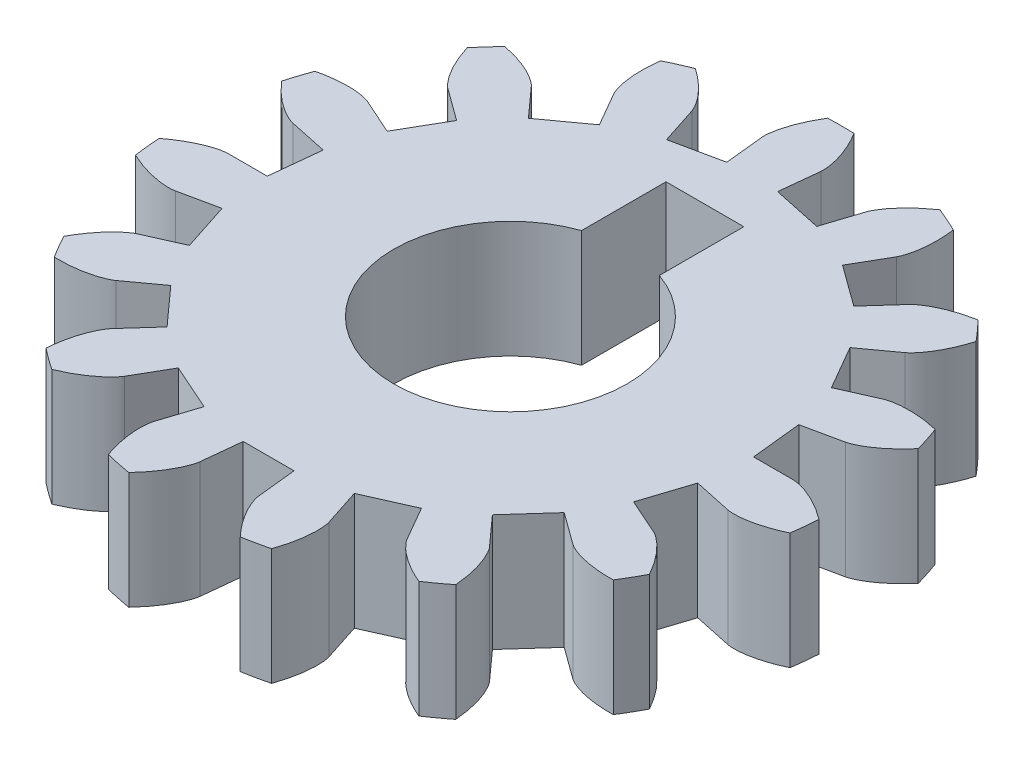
SolidWorks part; units mm, degrees
ref_plane "Front Plane" through (0, 0, 0) normal (0, 0, 1) x (1, 0, 0)
ref_plane "Top Plane" through (0, 0, 0) normal (0, 1, 0) x (1, 0, 0)
ref_plane "Right Plane" through (0, 0, 0) normal (1, 0, 0) x (0, 0, -1)
sketch "Sketch1" plane through (0, 0, 0) normal (0, 1, 0) x (1, 0, 0)
  line L0 (0, 0) -> (0, 3.6306) construction
  line L1 (0, 0) -> (-3.6306, 0) construction
  line L2 (0, 0) -> (-4.2267, -0.4442) construction
  line L3 (0, 0) -> (-3.5512, -0.7548) construction
  line L4 (0, 0) -> (-3.3167, -1.4767) construction
  circle A0 centre (0, 0) radius 3.75 construction
  circle A1 centre (0, 0) radius 3.6306 construction
  circle A2 centre (0, 0) radius 3.125 construction
  circle A3 centre (0, 0) radius 4.25 construction
  spline S0 degree 4 poles (-3.6306, 0) (-3.6359, 0) (-3.6507, -0.0005) (-3.6787, -0.0037) (-3.7239, -0.0119) (-3.7807, -0.0268) (-3.8526, -0.051) (-3.9353, -0.0858) (-4.0235, -0.1305) (-4.1162, -0.1857) (-4.2053, -0.2465) (-4.2909, -0.3123) (-4.3729, -0.3823) (-4.4682, -0.4722) (-4.5767, -0.5869) (-4.6942, -0.7301) (-4.816, -0.903) (-4.927, -1.0891) (-5.0252, -1.2799) (-5.1111, -1.4803) (-5.1846, -1.6795) (-5.2466, -1.8924) (-5.2965, -2.0922) (-5.3361, -2.3211) (-5.3633, -2.5075) (-5.3815, -2.7573) (-5.3869, -2.9058) (-5.3871, -3.0805) (-5.384, -3.1585) (-5.3821, -3.2065) knots 0 0 0 0 0 0.005377 0.015084 0.028532 0.04661 0.064855 0.092111 0.119476 0.146842 0.174209 0.201575 0.228941 0.256307 0.307035 0.361767 0.4165 0.471232 0.525964 0.580697 0.635429 0.690161 0.744894 0.799626 0.854358 0.909091 0.954545 1 1 1 1 1 construction
  spline S1 degree 4 poles (-3.6306, 0) (-3.6359, 0) (-3.6507, -0.0005) (-3.6787, -0.0037) (-3.7239, -0.0119) (-3.7807, -0.0268) (-3.8526, -0.051) (-3.9353, -0.0858) (-4.0235, -0.1305) (-4.1162, -0.1857) (-4.2053, -0.2465) (-4.2909, -0.3123) (-4.3729, -0.3823) (-4.4682, -0.4722) (-4.5767, -0.5869) (-4.6942, -0.7301) (-4.816, -0.903) (-4.927, -1.0891) (-5.0252, -1.2799) (-5.1111, -1.4803) (-5.1846, -1.6795) (-5.2466, -1.8924) (-5.2965, -2.0922) (-5.3361, -2.3211) (-5.3633, -2.5075) (-5.3775, -2.7031) (-5.3824, -2.7987) (-5.384, -2.8477) knots 0 0 0 0 0 0.005377 0.015084 0.028532 0.04661 0.064855 0.092111 0.119476 0.146842 0.174209 0.201575 0.228941 0.256307 0.307035 0.361767 0.4165 0.471232 0.525964 0.580697 0.635429 0.690161 0.744894 0.799626 0.854358 0.909091 0.909091 0.909091 0.909091 0.909091
  dimension "D1" = 8.5
  dimension "D2" = 7.5
  dimension "D3" = 7.2611
  dimension "D4" = 6.25
  dimension "D5" = 3.6306
  dimension "D6" = 6
  dimension "D7" = 12
  dimension "D8" = 24
sketch "Sketch2" plane through (0, 0, 0) normal (0, 1, 0) x (1, 0, 0)
  line L0 (0, 0) -> (-4.2267, -0.4442) construction
  line L1 (0, 0) -> (-4.2267, -0.4442) construction
  line L2 (0, 0) -> (-3.5512, -0.7548) construction
  line L3 (0, 0) -> (-3.6306, 0) construction
  line L4 (0, 0) -> (-3.3167, -1.4767) construction
  line L5 (0, 0) -> (-3.5512, -0.7548) construction
  line L6 (0, 0) -> (-3.6306, 0) construction
  line L7 (0, 0) -> (-3.3167, -1.4767) construction
  line L8 (-3.5512, -0.7548) -> (-3.0567, -0.6497)
  line L9 (-3.0567, -0.6497) -> (-2.8548, -1.2711)
  line L10 (-2.8548, -1.2711) -> (-3.3167, -1.4767) construction
  line L11 (-2.8548, -1.2711) -> (-1.3703, -0.6101)
  line L12 (-3.6306, 0) -> (-1.5, 0)
  circle A0 centre (0, 0) radius 3.125 construction
  circle A1 centre (0, 0) radius 3.6306 construction
  circle A2 centre (0, 0) radius 3.75 construction
  circle A3 centre (0, 0) radius 4.25 construction
  circle A4 centre (0, 0) radius 3.125 construction
  circle A5 centre (0, 0) radius 3.6306 construction
  circle A6 centre (0, 0) radius 3.75 construction
  circle A7 centre (0, 0) radius 4.25 construction
  arc A8 (-4.2055, -0.6131) -> (-4.2411, -0.2747) centre (0, 0) cw
  circle A11 centre (0, 0) radius 1.5 construction
  arc A12 (-1.5, 0) -> (-1.3703, -0.6101) centre (0, 0) ccw
  spline S0 degree 4 poles (-35.2015, -999.4516) (-2.6791, -17.0282) (-2.7402, -0.3247) (-3.2619, 0.0721) (-3.7239, -0.0119) (-3.7807, -0.0268) (-3.8526, -0.051) (-3.9353, -0.0858) (-4.0235, -0.1305) (-4.1162, -0.1857) (-4.2053, -0.2465) (-4.2909, -0.3123) (-4.3729, -0.3823) (-4.4682, -0.4722) (-4.5767, -0.5869) (-4.6942, -0.7301) (-4.816, -0.903) (-4.927, -1.0891) (-5.0252, -1.2799) (-5.1111, -1.4803) (-5.1846, -1.6795) (-5.2466, -1.8924) (-5.2965, -2.0922) (-5.3361, -2.3211) (-5.4648, -3.2033) (-5.367, -6.0337) (-3.9385, 25.6968) (-37.6488, -1002.3019) knots -0.429647 -0.429647 -0.429647 -0.429647 -0.429647 0.005377 0.015084 0.028532 0.04661 0.064855 0.092111 0.119476 0.146842 0.174209 0.201575 0.228941 0.256307 0.307035 0.361767 0.4165 0.471232 0.525964 0.580697 0.635429 0.690161 0.744894 0.799626 0.854358 1.726404 1.726404 1.726404 1.726404 1.726404 only from (-3.6306, 0) to (-5.384, -2.8477) construction
  spline S1 degree 4 poles (-3.6306, 0) (-3.6359, 0) (-3.6507, -0.0005) (-3.6787, -0.0037) (-3.7239, -0.0119) (-3.7807, -0.0268) (-3.8526, -0.051) (-3.9353, -0.0858) (-4.0235, -0.1305) (-4.1143, -0.1846) (-4.1795, -0.2289) (-4.2213, -0.2596) (-4.2411, -0.2747) knots 0 0 0 0 0 0.005377 0.015084 0.028532 0.04661 0.064855 0.092111 0.119476 0.146842 0.172079 0.172079 0.172079 0.172079 0.172079
  spline S2 degree 4 poles (-3.5512, -0.7548) (-3.5564, -0.7559) (-3.571, -0.7585) (-3.5991, -0.7612) (-3.645, -0.7626) (-3.7036, -0.7598) (-3.7791, -0.7511) (-3.8672, -0.7342) (-3.9627, -0.7089) (-4.0628, -0.6749) (-4.1358, -0.645) (-4.1831, -0.6237) (-4.2055, -0.6131) knots 0 0 0 0 0 0.005377 0.015084 0.028532 0.04661 0.064855 0.092111 0.119476 0.146842 0.172079 0.172079 0.172079 0.172079 0.172079
  point P21 (-3.0567, -0.6497)
  point P24 (-2.8548, -1.2711)
  dimension "D2" = 3
extrude "Boss-Extrude1" add sketch "Sketch2" along normal blind 1.5
pattern_circular "CirPattern1" count 15 over 360 of "Boss-Extrude1"
sketch "Sketch3" plane through (0, 1.5, 0) normal (0, 1, 0) x (1, 0, 0)
  line L1 (0.5, 0.5) -> (-0.5, 0.5)
  line L2 (0.5, 0.5) -> (0.5, 2.5)
  line L3 (0.5, 2.5) -> (-0.5, 2.5)
  line L4 (-0.5, 0.5) -> (-0.5, 2.5)
  line L5 (0.5, 0.5) -> (-0.5, 2.5) construction
  line L6 (0.5, 2.5) -> (-0.5, 0.5) construction
  circle A0 centre (0, 0) radius 1.5 construction
  point P0 (0, 1.5)
  dimension "D1" = 2
  dimension "D2" = 1
extrude "Cut-Extrude1" cut sketch "Sketch3" against normal up to surface (1.5 mm away)
equation "\"Module\"= .5"
equation "\"Number of Teeth\" = 15"
equation "\"Pressure Angle\"= 14.5deg"
equation "\"Pitch Diameter\"= \"Number of Teeth\" * \"Module\""
equation "\"Circular Pitch\"= pi * \"Module\""
equation "\"Addendum\"= \"Module\""
equation "\"Dedendum\"= 1.25 * \"Module\""
equation "\"Base Diameter\"= \"Pitch Diameter\" * cos ( \"Pressure Angle\" )"
equation "\"Base Radius\"= \"Base Diameter\" / 2"
equation "\"Width\"= 1.5"
equation "\"Outside Diameter\"= \"Pitch Diameter\" + 2 * \"Addendum\""
equation "\"D1@Sketch1\"=\"Outside Diameter\""
equation "\"D3@Sketch1\"=\"Base Diameter\""
equation "\"Root Diameter\"= \"Pitch Diameter\" - 2 * \"Dedendum\""
equation "\"D4@Sketch1\"=\"Root Diameter\""
equation "\"Tooth Angle\"= 360 / \"Number of Teeth\""
equation "\"D6@Sketch1\"=\"Tooth Angle\"/4"
equation "\"D7@Sketch1\"=\"Tooth Angle\"/2"
equation "\"D8@Sketch1\"=\"Tooth Angle\""
equation "\"D2@Sketch1\" = \"Pitch Diameter\""
equation "\"Shaft Diameter\"= 3"
equation "\"D1@CirPattern1\" = \"Number of Teeth\""
equation "\"D2@Sketch2\"= \"Shaft Diameter\""
equation "\"D1@Boss-Extrude1\" = \"Width\""
